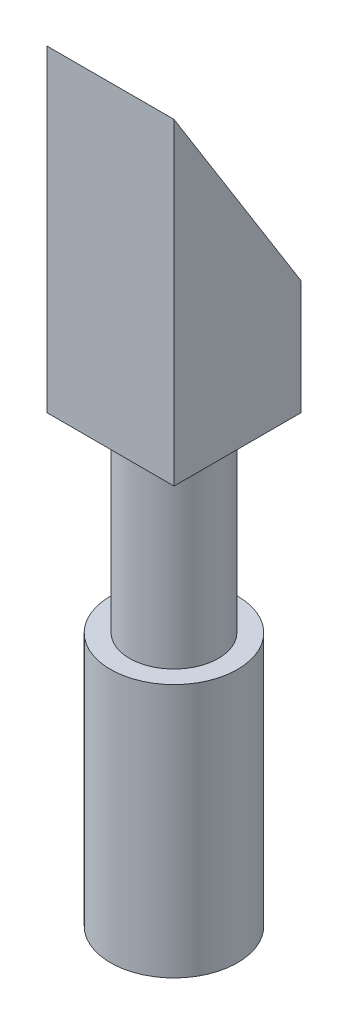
SolidWorks part; units mm, degrees
ref_plane "Front Plane" through (0, 0, 0) normal (0, 0, 1) x (1, 0, 0)
ref_plane "Top Plane" through (0, 0, 0) normal (0, 1, 0) x (1, 0, 0)
ref_plane "Right Plane" through (0, 0, 0) normal (1, 0, 0) x (0, 0, -1)
sketch "Sketch1" plane through (0, 0, 0) normal (0, 1, 0) x (1, 0, 0)
  line L1 (-5.506, 6.3453) -> (7.194, 6.3453)
  line L2 (-5.506, 6.3453) -> (-5.506, -6.3547)
  line L3 (-5.506, -6.3547) -> (7.194, -6.3547)
  line L4 (7.194, 6.3453) -> (7.194, -6.3547)
  line L5 (-5.506, 6.3453) -> (7.194, -6.3547) construction
  line L6 (-5.506, -6.3547) -> (7.194, 6.3453) construction
  point P0 (0.844, -0.0047)
  dimension "D1" = 12.7
  dimension "D2" = 12.7
extrude "Boss-Extrude1" add sketch "Sketch1" along normal blind 31.75
sketch "Sketch2" plane through (7.194, 0, 0) normal (1, 0, 0) x (0, 0, -1)
  line L0 (-6.3547, 31.75) -> (6.3453, 11.43)
  line L2 (6.3453, 31.75) -> (6.3453, 0) construction
extrude "Cut-Extrude1" cut sketch "Sketch2" against normal through all and the other way through all
sketch "Sketch3" plane through (0, 0, 0) normal (0, -1, 0) x (1, 0, 0)
  line L1 (7.194, 6.3547) -> (7.194, -6.3453) construction
  line L2 (-5.506, 6.3547) -> (7.194, 6.3547) construction
  line L3 (7.194, 6.3547) -> (-5.506, 6.3547)
  circle A0 centre (0.844, 0.0047) radius 4.445
  dimension "D1" = 8.89
extrude "Boss-Extrude2" add sketch "Sketch3" along normal blind 19.05 contours A0
sketch "Sketch4" plane through (0, -19.05, 0) normal (0, -1, 0) x (1, 0, 0)
  circle A0 centre (0.844, 0.0047) radius 6.35
  dimension "D1" = 12.7
extrude "Boss-Extrude4" add sketch "Sketch4" along normal blind 25.4
